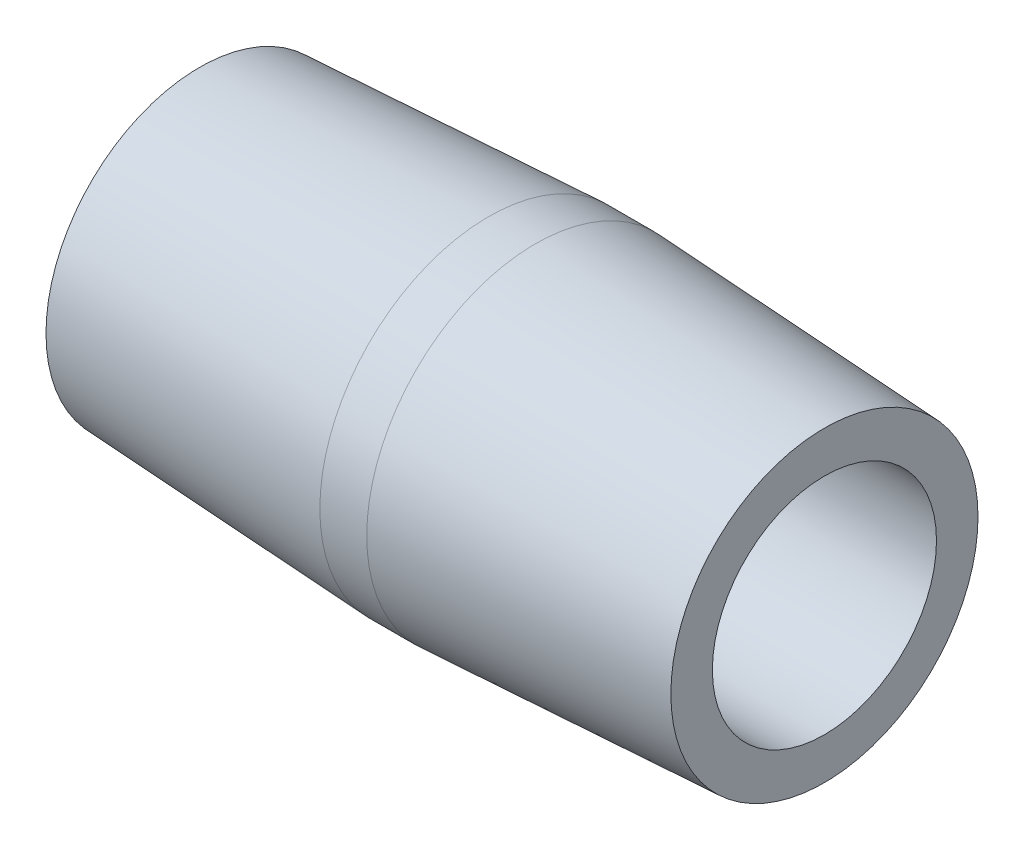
SolidWorks part; units mm, degrees
ref_plane "Front Plane" through (0, 0, 0) normal (0, 0, 1) x (1, 0, 0)
ref_plane "Top Plane" through (0, 0, 0) normal (0, 1, 0) x (1, 0, 0)
ref_plane "Right Plane" through (0, 0, 0) normal (1, 0, 0) x (0, 0, -1)
sketch "Sketch2" plane through (0, 0, 0) normal (0, 0, 1) x (1, 0, 0)
  line L0 (0.4761, 0) -> (50000.4761, 0) construction
  line L1 (0, -11.3625) -> (0, 49988.6375) construction
  line L7 (8.81, 5.1435) -> (0, 4.6818)
  line L8 (10.24, 5.1435) -> (8.81, 5.1435)
  line L9 (19.05, 4.6818) -> (10.24, 5.1435)
  line L10 (19.05, 3.4163) -> (19.05, 4.6818)
  line L11 (19.05, 3.4163) -> (0, 3.4163)
  line L12 (0, 4.6818) -> (0, 3.4163)
  dimension "D1" = 6.8326
  dimension "D2" = 10.287
  dimension "D3" = 3
  dimension "D4" = 3
  dimension "D5" = 8.81
  dimension "D6" = 8.81
  dimension "D7" = 19.05
revolve "Revolve1" add sketch "Sketch2" angle 360 about L0
